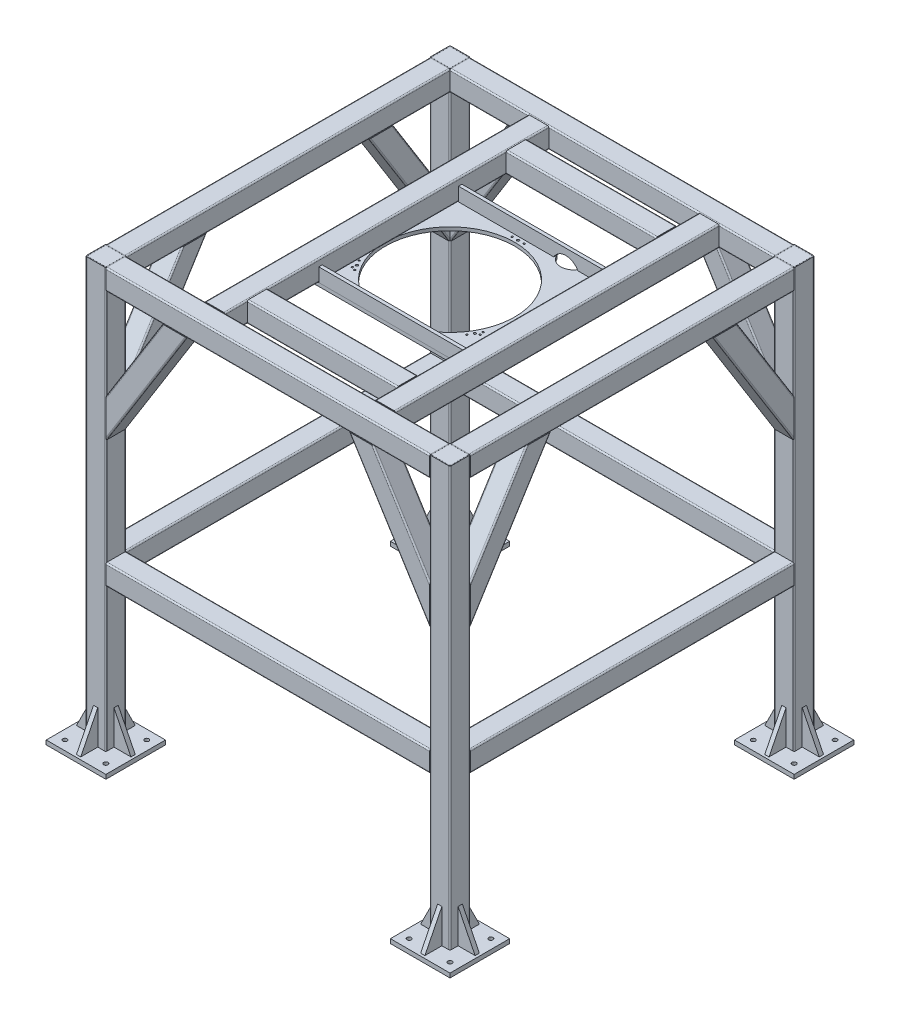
SolidWorks part; units mm, degrees
ref_plane "前视" through (0, 0, 0) normal (0, 0, 1) x (1, 0, 0)
ref_plane "上视" through (0, 0, 0) normal (0, 1, 0) x (1, 0, 0)
ref_plane "右视" through (0, 0, 0) normal (1, 0, 0) x (0, 0, -1)
sketch3d "3D草图2"
  line L0 (-1010, 0, 1010) -> (-1010, 2400, 1010)
  line L1 (-1010, 0, 1010) -> (-1010, 0, -1010)
  line L2 (-1010, 0, 1010) -> (1010, 0, 1010)
  line L3 (1010, 0, 1010) -> (1010, 0, -1010)
  line L4 (-1010, 0, -1010) -> (1010, 0, -1010)
  line L5 (-1010, 2400, 430) -> (1010, 2400, 430)
  line L6 (-1010, 2400, -430) -> (1010, 2400, -430)
  line L7 (-1010, 2400, -1010) -> (-1010, 2400, 1010)
  line L8 (-430, 2400, -1010) -> (-430, 2400, 1010)
  line L9 (-1010, 0, -1010) -> (-1010, 2400, -1010)
  line L10 (-1010, 2400, 1010) -> (1010, 2400, 1010)
  line L11 (570, 2400, -1010) -> (570, 2400, 1010)
  line L12 (1010, 2400, 1010) -> (1010, 2400, -1010)
  line L13 (1010, 2400, -1010) -> (-1010, 2400, -1010)
  line L14 (-1010, 900, 1010) -> (1010, 900, 1010)
  line L15 (1010, 900, 1010) -> (1010, 900, -1010)
  line L16 (-1010, 0, 0) -> (1010, 0, 0) construction
  line L17 (1010, 900, -1010) -> (-1010, 900, -1010)
  line L18 (-1010, 900, -1010) -> (-1010, 900, 1010)
  line L19 (-510, 2400, 1010) -> (-1010, 1600, 1010)
  line L20 (-1010, 1600, 1010) -> (-1010, 2400, 510)
  line L21 (510, 2400, 1010) -> (1010, 1600, 1010)
  line L22 (1010, 1600, 1010) -> (1010, 2400, 510)
  line L23 (1010, 2400, -510) -> (1010, 1600, -1010)
  line L24 (1010, 1600, -1010) -> (510, 2400, -1010)
  line L25 (-510, 2400, -1010) -> (-1010, 1600, -1010)
  line L26 (-1010, 1600, -1010) -> (-1010, 2400, -510)
  line L27 (-430, 2400, -760) -> (570, 2400, -760)
  line L28 (-430, 2400, 760) -> (570, 2400, 760)
  line L45 (1010, 2400, -1010) -> (1010, 0, -1010)
  line L47 (1010, 2400, 1010) -> (1010, 0, 1010)
  line L49 (1010, 2400, 0) -> (-1010, 2400, 0)
  dimension "D1" = 2020
  dimension "D2" = 2020
  dimension "D3" = 2400
  dimension "D7" = 1000
  dimension "D4" = 430
  dimension "D5" = 430
  dimension "D6" = 580
  dimension "D11" = 500
  dimension "D8" = 900
  dimension "D9" = 500
  dimension "D10" = 800
  dimension "D12" = 250
  dimension "D13" = 250
  dimension "D14" = 800
  dimension "D15" = 500
  dimension "D16" = 500
  dimension "D17" = 800
  dimension "D18" = 500
  dimension "D19" = 500
  dimension "D20" = 500
  dimension "D21" = 800
  dimension "D22" = 500
other "矩型管 120X60X4(1)"
ref_plane "基准面1" through (-1010, 0, -1010) normal (0, 1, 0) x (1, 0, 0)
sketch "Sketch12" plane through (-1010, 0, -1010) normal (0, 1, 0) x (1, 0, 0)
  line L0 (-52, -56) -> (52, -56)
  line L1 (-56, -52) -> (-56, 52)
  line L2 (52, 56) -> (-52, 56)
  line L3 (56, 52) -> (56, -52)
  line L4 (-52, -60) -> (52, -60)
  line L5 (-60, -52) -> (-60, 52)
  line L6 (52, 60) -> (-52, 60)
  line L7 (60, 52) -> (60, -52)
  arc A0 (60, 52) -> (52, 60) centre (52, 52) ccw
  arc A1 (52, -60) -> (60, -52) centre (52, -52) ccw
  arc A2 (-60, -52) -> (-52, -60) centre (-52, -52) ccw
  arc A3 (-52, 60) -> (-60, 52) centre (-52, 52) ccw
  arc A4 (-52, 56) -> (-56, 52) centre (-52, 52) ccw
  arc A5 (56, 52) -> (52, 56) centre (52, 52) ccw
  arc A6 (52, -56) -> (56, -52) centre (52, -52) ccw
  arc A7 (-56, -52) -> (-52, -56) centre (-52, -52) ccw
  point P0 (0, 60)
  point P1 (60, 0)
  point P2 (0, -60)
  point P3 (-60, 0)
  point P4 (-60, 60)
  point P5 (60, 60)
  point P6 (60, -60)
  point P7 (-60, -60)
  point P8 (0, 0)
  point P33 (0, 0)
other "剪裁/延伸7"
other "剪裁/延伸6"
sheet metal parameters "钣金2" thickness 3 parameters "D1"=0.7366
sheet metal parameters "钣金4" thickness 3 parameters "D1"=0.7366
sheet metal parameters "钣金7" thickness 1.5 parameters "D1"=0.7366
sheet metal parameters "钣金9" thickness 1.5 parameters "D1"=0.7366
sheet metal parameters "钣金15" thickness 2.5 parameters "D1"=0.7366
sheet metal parameters "钣金16" thickness 2.5 parameters "D1"=0.7366
sheet metal parameters "钣金17" thickness 2.5 parameters "D1"=0.7366
sheet metal parameters "钣金18" thickness 2.5 parameters "D1"=0.7366
sheet metal parameters "钣金19" thickness 2.5 parameters "D1"=0.7366
sheet metal parameters "钣金20" thickness 2.5 parameters "D1"=0.7366
sheet metal parameters "钣金21" thickness 2.5 parameters "D1"=0.7366
sheet metal parameters "钣金28" thickness 2.5 parameters "D1"=0.7366
sheet metal parameters "钣金29" thickness 2.5 parameters "D1"=0.7366
sheet metal parameters "钣金30" thickness 2 parameters "D1"=0.7366
other "剪裁/延伸8"
other "剪裁/延伸9"
other "剪裁/延伸10"
sketch "草图748" plane through (0, 0, 0) normal (0, -1, 0) x (1, 0, 0)
  line L6 (0, 534.4081) -> (0, 0) construction
  line L7 (0, 0) -> (-581.3586, 0) construction
  line L20 (950, 1070) -> (-950, 1070) construction
  line L21 (-835, 835) -> (-1185, 835)
  line L22 (-835, 835) -> (-835, 1185)
  line L23 (-835, 1185) -> (-1185, 1185)
  line L24 (-1185, 835) -> (-1185, 1185)
  line L25 (-835, 835) -> (-1185, 1185) construction
  line L26 (-835, 1185) -> (-1185, 835) construction
  line L27 (-1070, 950) -> (-1070, -950) construction
  line L28 (835, 1185) -> (1185, 835) construction
  line L29 (835, 835) -> (1185, 1185) construction
  line L30 (1185, 835) -> (1185, 1185)
  line L31 (835, 1185) -> (1185, 1185)
  line L32 (835, 835) -> (835, 1185)
  line L33 (835, 835) -> (1185, 835)
  line L34 (-835, -1185) -> (-1185, -835) construction
  line L35 (-835, -835) -> (-1185, -1185) construction
  line L36 (-1185, -835) -> (-1185, -1185)
  line L37 (-835, -1185) -> (-1185, -1185)
  line L38 (-835, -835) -> (-835, -1185)
  line L39 (-835, -835) -> (-1185, -835)
  line L40 (835, -835) -> (1185, -1185) construction
  line L41 (835, -1185) -> (1185, -835) construction
  line L42 (835, -835) -> (1185, -835)
  line L43 (835, -835) -> (835, -1185)
  line L44 (835, -1185) -> (1185, -1185)
  line L45 (1185, -835) -> (1185, -1185)
  point P0 (-1010, 1010)
  point P18 (1010, 1010)
  point P23 (-1010, -1010)
  point P28 (1010, -1010)
  dimension "D1" = 350
  dimension "D2" = 350
  dimension "D3" = 60
  dimension "D4" = 60
extrude "凸台-拉伸42" add sketch "草图748" along normal blind 25 separate body
sketch "草图755" plane through (0, 2340, 0) normal (0, -1, 0) x (1, 0, 0)
  line L0 (0, 0) -> (0, 240.19) construction
  line L6 (-430, 400) -> (570, 400)
  line L13 (0, 0) -> (-184.4464, 0) construction
  line L18 (-430, 400) -> (-430, -440)
  line L19 (-430, -440) -> (570, -440)
  line L20 (570, 400) -> (570, -440)
  line L21 (-370, 950) -> (-370, -950) construction
  line L22 (630, 950) -> (630, -950) construction
  circle A1 centre (0, 0) radius 380
  dimension "D1" = 840
  dimension "D2" = 760
  dimension "D3" = 400
  dimension "D4" = 60
  dimension "D5" = 60
extrude "凸台-拉伸43" add sketch "草图755" along normal blind 20 separate body
other "顶端盖1" parameters "D1"=5, "D2"=3, "D3"=3, "D4"=0
sketch "草图766" plane through (0, 2340, 0) normal (0, 1, 0) x (1, 0, 0)
  line L0 (510, -950) -> (510, 950) construction
  line L1 (-430, 440) -> (570, 440) construction
  circle A0 centre (260, 465) radius 75
  dimension "D1" = 250
  dimension "D2" = 150
  dimension "D3" = 25
extrude "切除-拉伸1" cut sketch "草图766" against normal through all
hole_wizard "M16 螺纹孔2" positions "草图767" profile "草图768" tap size "M16" standard "GB"
sketch "草图767" plane through (0, 2340, 0) normal (0, 1, 0) x (1, 0, 0)
  point P0 (0, 400)
  dimension "D1" = 400
sketch "草图768" plane through (0, 2340, -400) normal (1, 0, 0) x (0, 0, 1)
  line L0 (0, 0) -> (0, 42.206)
  line L1 (0, 42.206) -> (7, 38)
  line L2 (7, 38) -> (7, 0)
  line L5 (7, 0) -> (0, 0)
  line L10 (0, 42.206) -> (-7, 38) construction
  line L11 (0, -6.35) -> (0, 107.95) construction
  dimension "螺纹孔钻头直径" = 14
  dimension "螺纹孔钻头深度" = 38
  dimension "导头角度" = 118
hole_wizard "M12 螺纹孔2" positions "草图769" profile "草图770" tap size "M12" standard "GB"
sketch "草图769" plane through (0, 2340, 0) normal (0, 1, 0) x (1, 0, 0)
  line L0 (0, 0) -> (0, 157.172) construction
  line L2 (-35, 400) -> (0, 0) construction
  line L4 (35, 400) -> (0, 0) construction
  circle A0 centre (0, 400) radius 7 construction
  point P0 (35, 400)
  point P2 (-35, 400)
  dimension "D3" = 35
  dimension "D1" = 400
  dimension "D2" = 35
sketch "草图770" plane through (35, 2340, -400) normal (1, 0, 0) x (0, 0, 1)
  line L0 (0, 0) -> (0, 35.8144)
  line L1 (0, 35.8144) -> (5.1, 32.75)
  line L2 (5.1, 32.75) -> (5.1, 0)
  line L5 (5.1, 0) -> (0, 0)
  line L10 (0, 35.8144) -> (-5.1, 32.75) construction
  line L11 (0, -6.35) -> (0, 107.95) construction
  dimension "螺纹孔钻头直径" = 10.2
  dimension "螺纹孔钻头深度" = 32.75
  dimension "导头角度" = 118
pattern_circular "阵列(圆周)2" count 3 over 360 about axis through (0, 0, 0) along (0, 1, 0) of "M16 螺纹孔2", "M12 螺纹孔2"
sketch "草图771" plane through (0, 2340, 0) normal (0, 1, 0) x (1, 0, 0)
  line L0 (-370, -950) -> (-370, 950) construction
  line L1 (-370, 440) -> (510, 440)
  line L2 (-370, 440) -> (-370, 420)
  line L3 (-370, 420) -> (510, 420)
  line L4 (510, 440) -> (510, 420)
  line L5 (-430, 440) -> (189.2893, 440) construction
  line L6 (510, -950) -> (510, 950) construction
  line L7 (0, 0) -> (125.4763, 0) construction
  line L12 (570, -400) -> (-430, -400) construction
  line L13 (-370, -400) -> (510, -400)
  line L14 (-370, -400) -> (-370, -380)
  line L15 (-370, -380) -> (510, -380)
  line L16 (510, -400) -> (510, -380)
  dimension "D1" = 20
  dimension "D2" = 20
extrude "凸台-拉伸45" add sketch "草图771" along normal blind 80 separate body
sketch "草图772" plane through (0, 0, -440) normal (0, 0, -1) x (-1, 0, 0)
  line L0 (-510, 2340) -> (370, 2340) construction
  line L1 (-189.2893, 2340) -> (-189.2893, 2320) construction
  line L2 (-330.7107, 2340) -> (-189.2893, 2340)
  arc A1 (-330.7107, 2340) -> (-189.2893, 2340) centre (-260, 2302.5834) cw
  dimension "D1" = 80
extrude "切除-拉伸2" cut sketch "草图772" against normal blind 20 and the other way through all
hole_wizard "大小mm 暗销孔1" positions "草图773" profile "草图774" hole size "Ø10.0" standard "GB"
sketch "草图773" plane through (0, 2340, 0) normal (0, 1, 0) x (1, 0, 0)
  line L0 (0, 0) -> (0, -491.527) construction
  line L2 (0, 0) -> (-350.0075, -222.9793) construction
  line L5 (0, 0) -> (368.1095, -191.6257) construction
  point P0 (-350.0075, -222.9793)
  point P25 (368.1095, -191.6257)
  dimension "D1" = 57.5
  dimension "D2" = 415
  dimension "D3" = 62.5
  dimension "D4" = 415
sketch "草图774" plane through (-350.0075, 2340, 222.9793) normal (1, 0, 0) x (0, 0, 1)
  line L0 (0, 0) -> (0, 35.7543)
  line L1 (0, 35.7543) -> (5, 32.75)
  line L2 (5, 32.75) -> (5, 0)
  line L5 (5, 0) -> (0, 0)
  line L10 (0, 35.7543) -> (-5, 32.75) construction
  line L11 (0, -6.35) -> (0, 107.95) construction
  dimension "孔直径" = 10
  dimension "孔深度" = 32.75
  dimension "导头角度" = 118
hole_wizard "大小mm 暗销孔2" positions "草图777" profile "草图778" hole size "Ø25.0" standard "GB"
sketch "草图777" plane through (0, -25, 0) normal (0, -1, 0) x (-1, 0, 0)
  line L0 (1010, 1185) -> (1010, 1340.0806) construction
  line L1 (1185, 1185) -> (835, 1185) construction
  line L3 (1185, 1010) -> (1341.1589, 1010) construction
  line L4 (1185, 835) -> (1185, 1185) construction
  line L6 (0, 0) -> (710.3979, 0) construction
  line L8 (1185, -1010) -> (1341.1589, -1010) construction
  line L9 (1010, -1185) -> (1010, -1340.0806) construction
  line L10 (0, 0) -> (0, 304.3272) construction
  line L12 (-1010, -1185) -> (-1010, -1340.0806) construction
  line L13 (-1185, -1010) -> (-1341.1589, -1010) construction
  line L14 (-1185, 1010) -> (-1341.1589, 1010) construction
  line L15 (-1010, 1185) -> (-1010, 1340.0806) construction
  point P0 (1130, 1130)
  point P2 (1130, 890)
  point P4 (890, 890)
  point P6 (890, 1130)
  point P34 (890, -1130)
  point P35 (890, -890)
  point P36 (1130, -890)
  point P37 (1130, -1130)
  point P50 (-1130, -1130)
  point P51 (-1130, -890)
  point P52 (-890, -890)
  point P53 (-890, -1130)
  point P54 (-890, 1130)
  point P55 (-890, 890)
  point P56 (-1130, 890)
  point P57 (-1130, 1130)
  dimension "D1" = 240
  dimension "D2" = 240
sketch "草图778" plane through (-1130, -25, -1130) normal (1, 0, 0) x (0, 0, -1)
  line L0 (0, 0) -> (0, 40.2608)
  line L1 (0, 40.2608) -> (12.5, 32.75)
  line L2 (12.5, 32.75) -> (12.5, 0)
  line L5 (12.5, 0) -> (0, 0)
  line L10 (0, 40.2608) -> (-12.5, 32.75) construction
  line L11 (0, -6.35) -> (0, 107.95) construction
  dimension "孔直径" = 25
  dimension "孔深度" = 32.75
  dimension "导头角度" = 118
other "角撑板1" parameters "D1"=25, "D2"=25, "D3"=0, "D4"=0, "D10"=5, "D11"=200, "D12"=100, "D13"=15, "D14"=45, "D15"=15
sketch "草图779" plane through (-1010, 0, 1070) normal (1, 0, 0) x (0, 0, -1)
  line L0 (0, 0) -> (0, 200)
  line L1 (0, 0) -> (-100, 0)
  line L2 (0, 200) -> (-100, 0)
other "角撑板2" parameters "D1"=25, "D2"=25, "D3"=0, "D4"=0, "D10"=5, "D11"=200, "D12"=100, "D13"=15, "D14"=45, "D15"=15
sketch "草图780" plane through (-1070, 0, 1010) normal (0, 0, 1) x (1, 0, 0)
  line L0 (0, 0) -> (0, 200)
  line L1 (0, 0) -> (-100, 0)
  line L2 (0, 200) -> (-100, 0)
other "角撑板3" parameters "D1"=25, "D2"=25, "D3"=0, "D4"=0, "D10"=5, "D11"=200, "D12"=100, "D13"=15, "D14"=45, "D15"=15
sketch "草图781" plane through (-950, 0, 1010) normal (0, 0, -1) x (-1, 0, 0)
  line L0 (0, 0) -> (0, 200)
  line L1 (0, 0) -> (-100, 0)
  line L2 (0, 200) -> (-100, 0)
other "角撑板4" parameters "D1"=25, "D2"=25, "D3"=0, "D4"=0, "D10"=5, "D11"=200, "D12"=100, "D13"=15, "D14"=45, "D15"=15
sketch "草图782" plane through (-1010, 0, 950) normal (-1, 0, 0) x (0, 0, 1)
  line L0 (0, 0) -> (0, 200)
  line L1 (0, 0) -> (-100, 0)
  line L2 (0, 200) -> (-100, 0)
mirror "镜向1" about plane through (0, 0, 0) normal (1, 0, 0) of "角撑板3", "角撑板4", "角撑板1", "角撑板2"
mirror "镜向2" about plane through (0, 0, 0) normal (0, 0, 1) of "镜向1", "角撑板3", "角撑板4", "角撑板2", "角撑板1"
flat pattern "平板型式2"
sketch "折弯-线2" plane through (0, 0, 0) normal (0, 1, 0) x (1, 0, 0)
sketch "边界框2" [suppressed] plane through (0, 0, 0) normal (0, 1, 0) x (1, 0, 0)
flat pattern "平板型式4"
sketch "折弯-线4" plane through (0, 0, 0) normal (0, 1, 0) x (1, 0, 0)
sketch "边界框4" [suppressed] plane through (0, 0, 0) normal (0, 1, 0) x (1, 0, 0)
flat pattern "平板型式7"
sketch "折弯-线7" plane through (0, 0, 0) normal (0, 1, 0) x (1, 0, 0)
sketch "边界框7" [suppressed] plane through (0, 0, 0) normal (0, 1, 0) x (1, 0, 0)
flat pattern "平板型式9"
sketch "折弯-线9" plane through (0, 0, 0) normal (0, 1, 0) x (1, 0, 0)
sketch "边界框9" [suppressed] plane through (0, 0, 0) normal (0, 1, 0) x (1, 0, 0)
flat pattern "平板型式15"
sketch "折弯-线15" plane through (0, 0, 0) normal (0, 1, 0) x (1, 0, 0)
sketch "边界框15" [suppressed] plane through (0, 0, 0) normal (0, 1, 0) x (1, 0, 0)
flat pattern "平板型式16"
sketch "折弯-线16" plane through (0, 0, 0) normal (0, 1, 0) x (1, 0, 0)
sketch "边界框16" [suppressed] plane through (0, 0, 0) normal (0, 1, 0) x (1, 0, 0)
flat pattern "平板型式17"
sketch "折弯-线17" plane through (0, 0, 0) normal (0, 1, 0) x (1, 0, 0)
sketch "边界框17" [suppressed] plane through (0, 0, 0) normal (0, 1, 0) x (1, 0, 0)
flat pattern "平板型式18"
sketch "折弯-线18" plane through (0, 0, 0) normal (0, 1, 0) x (1, 0, 0)
sketch "边界框18" [suppressed] plane through (0, 0, 0) normal (0, 1, 0) x (1, 0, 0)
flat pattern "平板型式19"
sketch "折弯-线19" plane through (0, 0, 0) normal (0, 1, 0) x (1, 0, 0)
sketch "边界框19" [suppressed] plane through (0, 0, 0) normal (0, 1, 0) x (1, 0, 0)
flat pattern "平板型式20"
sketch "折弯-线20" plane through (0, 0, 0) normal (0, 1, 0) x (1, 0, 0)
sketch "边界框20" [suppressed] plane through (0, 0, 0) normal (0, 1, 0) x (1, 0, 0)
flat pattern "平板型式21"
sketch "折弯-线21" plane through (0, 0, 0) normal (0, 1, 0) x (1, 0, 0)
sketch "边界框21" [suppressed] plane through (0, 0, 0) normal (0, 1, 0) x (1, 0, 0)
flat pattern "平板型式28"
sketch "折弯-线28" plane through (0, 0, 0) normal (0, 1, 0) x (1, 0, 0)
sketch "边界框28" [suppressed] plane through (0, 0, 0) normal (0, 1, 0) x (1, 0, 0)
flat pattern "平板型式29"
sketch "折弯-线29" plane through (0, 0, 0) normal (0, 1, 0) x (1, 0, 0)
sketch "边界框29" [suppressed] plane through (0, 0, 0) normal (0, 1, 0) x (1, 0, 0)
flat pattern "平板型式30"
sketch "折弯-线30" plane through (0, 0, 0) normal (0, 1, 0) x (1, 0, 0)
sketch "边界框30" [suppressed] plane through (0, 0, 0) normal (0, 1, 0) x (1, 0, 0)
equation "\"D1@Sketch12\" = \"Thickness@Sketch12\" * 2"
